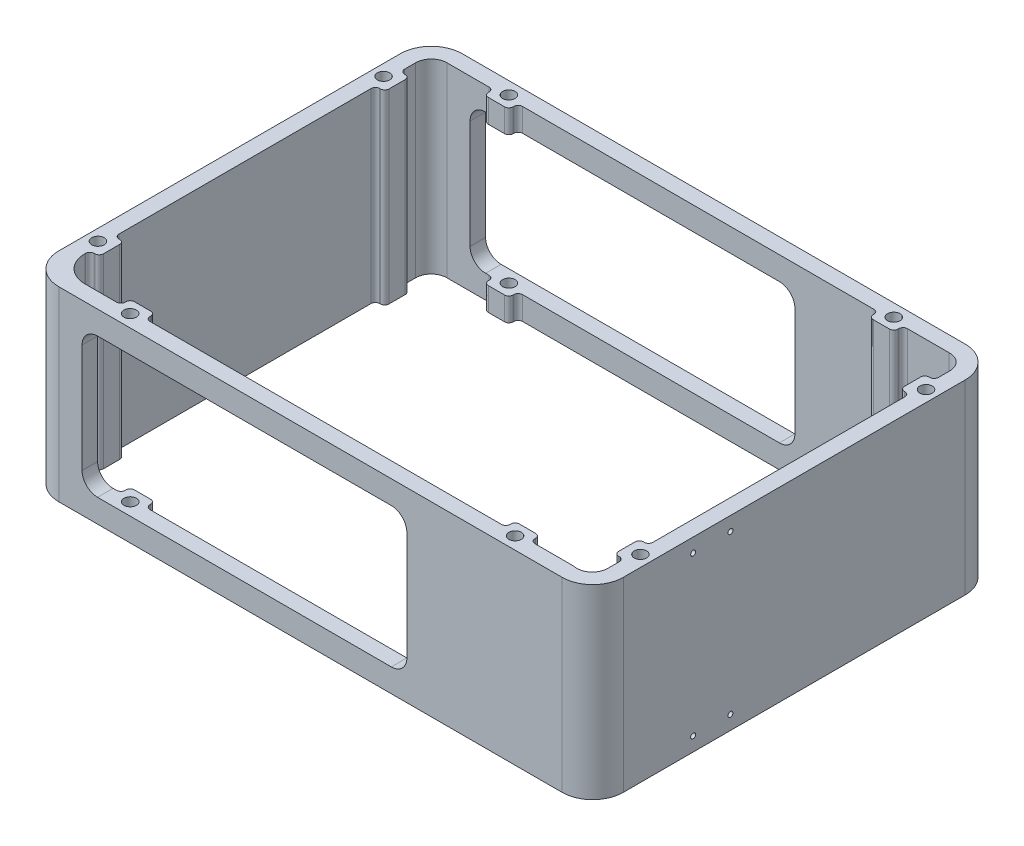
SolidWorks part; units mm, degrees
ref_plane "Front Plane" through (0, 0, 0) normal (0, 0, 1) x (1, 0, 0)
ref_plane "Top Plane" through (0, 0, 0) normal (0, 1, 0) x (1, 0, 0)
ref_plane "Right Plane" through (0, 0, 0) normal (1, 0, 0) x (0, 0, -1)
sketch "Sketch1" plane through (0, 0, 0) normal (0, 1, 0) x (1, 0, 0)
  line L0 (91, 49.75) -> (91, -5.75)
  line L1 (91, -31.75) -> (91, -60.3819)
  line L2 (-81, -70.2508) -> (81.1312, -70.2508)
  line L3 (-91, 49.7492) -> (-91, -60.2508)
  line L4 (-81, 59.7492) -> (81.1237, 59.7492)
  line L5 (91, -5.75) -> (91, -31.75)
  line L6 (86, 49.75) -> (86, 46.1374)
  line L7 (86, -56.6389) -> (86, -60.3819)
  line L8 (-77.62, -65.2508) -> (-67.3882, -65.2508)
  line L9 (-86, 49.7448) -> (-86, 46.1374)
  line L10 (-81, 54.7492) -> (-67.3882, 54.7492)
  line L11 (-86, -56.6389) -> (-86, -56.8707)
  line L12 (-84.6118, -47.2508) -> (-84.3882, -47.2508)
  line L13 (-84.6118, -55.2508) -> (-84.3882, -55.2508)
  line L14 (-83, -48.6389) -> (-83, -53.8626)
  line L15 (-66, -63.8626) -> (-66, -63.6389)
  line L16 (-64.6118, -62.2508) -> (-59.3882, -62.2508)
  line L17 (-58, -63.8626) -> (-58, -63.6389)
  line L18 (-56.6118, -65.2508) -> (56.6118, -65.2508)
  line L19 (-91, -5.2508) -> (-37.5, -5.2508) construction
  line L20 (0, 54.75) -> (0, -18.75) construction
  line L21 (-58, 53.3611) -> (-58, 53.1374)
  line L22 (-66, 53.3611) -> (-66, 53.1374)
  line L23 (-64.6118, 51.7492) -> (-59.3882, 51.7492)
  line L24 (-83, 38.1374) -> (-83, 43.3611)
  line L25 (-84.6118, 44.7492) -> (-84.3882, 44.7492)
  line L26 (-84.6118, 36.7492) -> (-84.3882, 36.7492)
  line L27 (83, -48.6389) -> (83, -53.8626)
  line L28 (84.6118, -55.2508) -> (84.3882, -55.2508)
  line L29 (58, -63.8626) -> (58, -63.6389)
  line L30 (66, -63.8626) -> (66, -63.6389)
  line L31 (64.6118, -62.2508) -> (59.3882, -62.2508)
  line L32 (67.3882, -65.2508) -> (79.8623, -65.2508)
  line L33 (84.6073, 36.7545) -> (84.3927, 36.7538)
  line L34 (83, 38.1419) -> (83, 43.3611)
  line L35 (84.6118, 44.7492) -> (84.3882, 44.7492)
  line L36 (66, 53.3611) -> (66, 53.1374)
  line L37 (64.6118, 51.7492) -> (59.3882, 51.7492)
  line L38 (58, 53.3611) -> (58, 53.1374)
  line L39 (67.3882, 54.7492) -> (80.771, 54.7492)
  line L40 (86, 35.3663) -> (86, -5.75)
  line L41 (86, -5.75) -> (86, -45.8626)
  line L42 (84.6118, -47.2508) -> (84.3882, -47.2508)
  line L43 (-86, 35.3611) -> (-86, -45.8626)
  line L44 (-56.6118, 54.7492) -> (56.6118, 54.7492)
  arc A0 (91, 49.75) -> (81.1237, 59.7492) centre (81, 49.75) ccw
  arc A1 (81.1312, -70.2508) -> (91, -60.3819) centre (81.1312, -60.3819) ccw
  arc A2 (-91, -60.2508) -> (-81, -70.2508) centre (-81, -60.2508) ccw
  arc A3 (-81, 59.7492) -> (-91, 49.7492) centre (-81, 49.7492) ccw
  arc A4 (79.8623, -65.2508) -> (86, -60.3819) centre (81, -60.3819) ccw
  arc A5 (-86, -56.8707) -> (-77.62, -65.2508) centre (-77.62, -56.8707) ccw
  arc A6 (-81, 54.7492) -> (-86, 49.7448) centre (-81, 49.7492) ccw
  arc A7 (86, 49.75) -> (80.771, 54.7492) centre (81, 49.7545) ccw
  arc A8 (-86, -56.6389) -> (-84.6118, -55.2508) centre (-84.6118, -56.6389) cw
  arc A9 (-86, -45.8626) -> (-84.6118, -47.2508) centre (-84.6118, -45.8626) ccw
  arc A10 (-84.3882, -47.2508) -> (-83, -48.6389) centre (-84.3882, -48.6389) cw
  arc A11 (-84.3882, -55.2508) -> (-83, -53.8626) centre (-84.3882, -53.8626) ccw
  arc A12 (-58, -63.8626) -> (-56.6118, -65.2508) centre (-56.6118, -63.8626) ccw
  arc A13 (-59.3882, -62.2508) -> (-58, -63.6389) centre (-59.3882, -63.6389) cw
  arc A14 (-66, -63.6389) -> (-64.6118, -62.2508) centre (-64.6118, -63.6389) cw
  arc A15 (-67.3882, -65.2508) -> (-66, -63.8626) centre (-67.3882, -63.8626) ccw
  arc A16 (66, -63.8626) -> (67.3882, -65.2508) centre (67.3882, -63.8626) ccw
  arc A17 (66, -63.6389) -> (64.6118, -62.2508) centre (64.6118, -63.6389) ccw
  arc A18 (58, -63.6389) -> (59.3882, -62.2508) centre (59.3882, -63.6389) cw
  arc A19 (56.6118, -65.2508) -> (58, -63.8626) centre (56.6118, -63.8626) ccw
  arc A20 (86, -56.6389) -> (84.6118, -55.2508) centre (84.6118, -56.6389) ccw
  arc A21 (83, -53.8626) -> (84.3882, -55.2508) centre (84.3882, -53.8626) ccw
  arc A22 (83, -48.6389) -> (84.3882, -47.2508) centre (84.3882, -48.6389) cw
  arc A23 (86, -45.8626) -> (84.6118, -47.2508) centre (84.6118, -45.8626) cw
  arc A24 (84.6073, 36.7545) -> (86, 35.3663) centre (84.6118, 35.3663) cw
  arc A25 (84.3927, 36.7538) -> (83, 38.1419) centre (84.3882, 38.1419) cw
  arc A26 (86, 46.1374) -> (84.6118, 44.7492) centre (84.6118, 46.1374) cw
  arc A27 (83, 43.3611) -> (84.3882, 44.7492) centre (84.3882, 43.3611) cw
  arc A28 (64.6118, 51.7492) -> (66, 53.1374) centre (64.6118, 53.1374) ccw
  arc A29 (59.3882, 51.7492) -> (58, 53.1374) centre (59.3882, 53.1374) cw
  arc A30 (66, 53.3611) -> (67.3882, 54.7492) centre (67.3882, 53.3611) cw
  arc A31 (56.6118, 54.7492) -> (58, 53.3611) centre (56.6118, 53.3611) cw
  arc A32 (-58, 53.3611) -> (-56.6118, 54.7492) centre (-56.6118, 53.3611) cw
  arc A33 (-58, 53.1374) -> (-59.3882, 51.7492) centre (-59.3882, 53.1374) cw
  arc A34 (-66, 53.3611) -> (-67.3882, 54.7492) centre (-67.3882, 53.3611) ccw
  arc A35 (-66, 53.1374) -> (-64.6118, 51.7492) centre (-64.6118, 53.1374) ccw
  arc A36 (-84.6118, 36.7492) -> (-86, 35.3611) centre (-84.6118, 35.3611) ccw
  arc A37 (-83, 38.1374) -> (-84.3882, 36.7492) centre (-84.3882, 38.1374) cw
  arc A38 (-83, 43.3611) -> (-84.3882, 44.7492) centre (-84.3882, 43.3611) ccw
  arc A39 (-84.6118, 44.7492) -> (-86, 46.1374) centre (-84.6118, 46.1374) cw
  circle A40 centre (-87.3806, 40.7492) radius 2
  circle A41 centre (-87.3806, -51.2508) radius 2
  circle A42 centre (-62, 55.7492) radius 2
  circle A43 centre (-62, -66.2508) radius 2
  circle A44 centre (62, -66.2508) radius 2
  circle A45 centre (87.3806, -51.2508) radius 2
  circle A46 centre (87.3806, 40.7492) radius 2
  circle A47 centre (62, 55.7492) radius 2
  point P63 (-83, 40.7492)
  point P69 (0, 0)
  point P72 (-86, -55.2508)
  point P75 (-86, -47.2508)
  point P78 (-83, -47.2508)
  point P81 (-83, -55.2508)
  point P84 (-58, -65.2508)
  point P87 (-58, -62.2508)
  point P90 (-66, -62.2508)
  point P93 (-66, -65.2508)
  point P96 (66, -65.2508)
  point P99 (66, -62.2508)
  point P102 (58, -62.2508)
  point P105 (58, -65.2508)
  point P108 (86, -55.2508)
  point P111 (83, -55.2508)
  point P114 (83, -47.2508)
  point P121 (83, 36.7492)
  point P124 (86, 44.7492)
  point P127 (83, 44.7492)
  point P130 (66, 51.7492)
  point P133 (58, 51.7492)
  point P136 (66, 54.7492)
  point P139 (58, 54.7492)
  point P142 (-58, 54.7492)
  point P145 (-58, 51.7492)
  point P148 (-66, 54.7492)
  point P151 (-66, 51.7492)
  point P154 (-86, 36.7492)
  point P157 (-83, 36.7492)
  point P160 (-83, 44.7492)
  point P163 (-86, 44.7492)
  point P166 (-62, 51.7492)
  dimension "D10" = 10
  dimension "D12" = 1.3882
  dimension "D13" = 4
  dimension "D1" = 3
  dimension "D2" = 3
  dimension "D3" = 8
  dimension "D4" = 8
  dimension "D5" = 20
  dimension "D6" = 10
  dimension "D7" = 8
  dimension "D8" = 5
  dimension "D9" = 5
  dimension "D11" = 5
  dimension "D14" = 3.6194
  dimension "D15" = 0
  dimension "D16" = 4
  dimension "D17" = 0
  dimension "D18" = 130
extrude "Boss-Extrude1" add sketch "Sketch1" along normal blind 60
sketch "Sketch2" plane through (0, 0, 70.2508) normal (0, 0, 1) x (1, 0, 0)
  line L0 (-81, 0) -> (81.1312, 0) construction
  line L1 (-68.5, 7.5) -> (26.1312, 7.5)
  line L2 (-73.5, 12.5) -> (-73.5, 47.5)
  line L3 (-68.5, 52.5) -> (26.1312, 52.5)
  line L4 (31.1312, 12.5) -> (31.1312, 47.5)
  line L5 (-81, 60) -> (81.1312, 60) construction
  line L6 (-81, 60) -> (-81, 0) construction
  line L7 (81.1312, 60) -> (81.1312, 0) construction
  arc A0 (-68.5, 7.5) -> (-73.5, 12.5) centre (-68.5, 12.5) cw
  arc A1 (26.1312, 7.5) -> (31.1312, 12.5) centre (26.1312, 12.5) ccw
  arc A2 (26.1312, 52.5) -> (31.1312, 47.5) centre (26.1312, 47.5) cw
  arc A3 (-73.5, 47.5) -> (-68.5, 52.5) centre (-68.5, 47.5) cw
  dimension "D5" = 5
  dimension "D1" = 7.5
  dimension "D2" = 7.5
  dimension "D3" = 7.5
  dimension "D4" = 50
extrude "Cut-Extrude1" cut sketch "Sketch2" against normal through all
sketch "Sketch3" plane through (91, 0, 0) normal (1, 0, 0) x (0, 0, -1)
  line L0 (-37.8819, 60) -> (-37.8819, 51) construction
  line L1 (-60.3819, 60) -> (49.75, 60) construction
  line L2 (-60.3819, 60) -> (-60.3819, 0) construction
  line L3 (-37.8819, 55.5) -> (-25.8819, 55.5) construction
  line L4 (-25.8819, 60) -> (-25.8819, 55.5) construction
  line L5 (-60.3819, 30) -> (-49.2233, 30) construction
  line L6 (-25.8819, 0) -> (-25.8819, 4.5) construction
  line L7 (-37.8819, 4.5) -> (-25.8819, 4.5) construction
  line L8 (-37.8819, 0) -> (-37.8819, 9) construction
  circle A0 centre (-37.8819, 55.5) radius 0.8
  circle A1 centre (-25.8819, 55.5) radius 0.8
  circle A2 centre (-25.8819, 4.5) radius 0.8
  circle A3 centre (-37.8819, 4.5) radius 0.8
  dimension "D2" = 1.6
  dimension "D5" = 1.6
  dimension "D1" = 22.5
  dimension "D3" = 4.5
  dimension "D4" = 12
extrude "Cut-Extrude2" cut sketch "Sketch3" against normal blind 12
